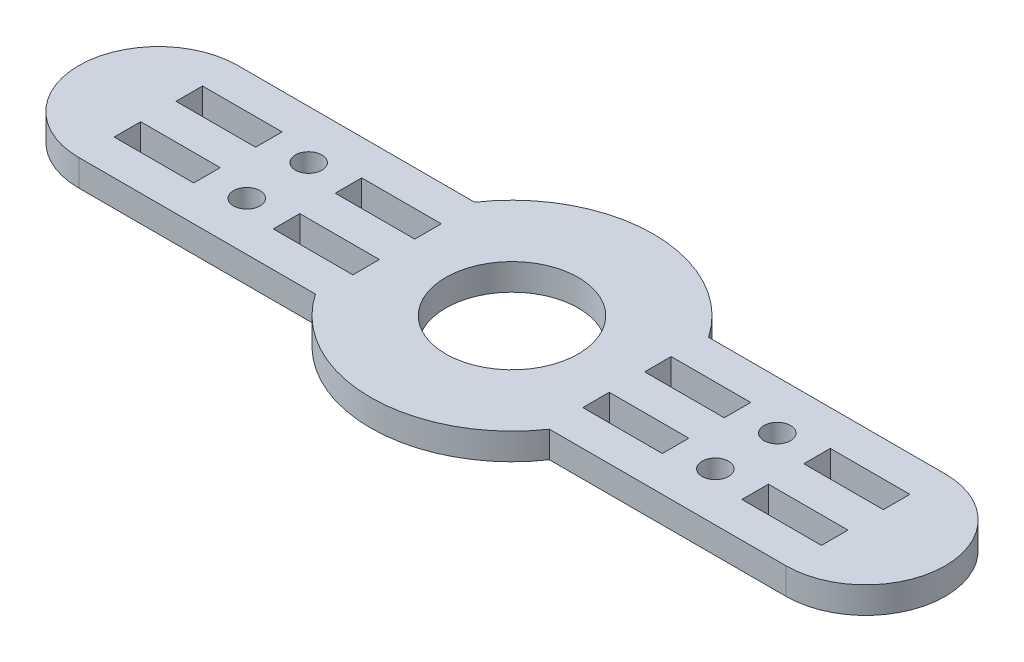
SolidWorks part; units mm, degrees
ref_plane "Front Plane" through (0, 0, 0) normal (0, 0, 1) x (1, 0, 0)
ref_plane "Top Plane" through (0, 0, 0) normal (0, 1, 0) x (1, 0, 0)
ref_plane "Right Plane" through (0, 0, 0) normal (1, 0, 0) x (0, 0, -1)
sketch "Sketch1" plane through (0, 0, 0) normal (0, 1, 0) x (1, 0, 0)
  line L0 (-40, 0) -> (40, 0) construction
  line L1 (-40, 9) -> (40, 9)
  line L2 (-40, -9) -> (40, -9)
  line L3 (-1033.412, 3.5) -> (48966.588, 3.5) construction
  line L4 (-1033.412, -3.5) -> (48966.588, -3.5) construction
  line L5 (-1000, 0) -> (49000, 0) construction
  line L6 (-22, -5) -> (-13, -5)
  line L7 (-22, -5) -> (-22, -2)
  line L8 (-22, -2) -> (-13, -2)
  line L9 (-13, -5) -> (-13, -2)
  line L10 (-22, -5) -> (-13, -2) construction
  line L11 (-22, -2) -> (-13, -5) construction
  line L12 (-40, -5) -> (-31, -5)
  line L13 (-40, -5) -> (-40, -2)
  line L14 (-40, -2) -> (-31, -2)
  line L15 (-31, -5) -> (-31, -2)
  line L16 (-40, -5) -> (-31, -2) construction
  line L17 (-40, -2) -> (-31, -5) construction
  line L18 (-40, 2) -> (-31, 5) construction
  line L19 (-40, 5) -> (-31, 2) construction
  line L20 (-22, 2) -> (-13, 5) construction
  line L21 (-22, 5) -> (-13, 2) construction
  line L22 (-31, 5) -> (-31, 2)
  line L23 (-40, 2) -> (-31, 2)
  line L24 (-40, 5) -> (-40, 2)
  line L25 (-40, 5) -> (-31, 5)
  line L26 (-13, 5) -> (-13, 2)
  line L27 (-22, 2) -> (-13, 2)
  line L28 (-22, 5) -> (-22, 2)
  line L29 (-22, 5) -> (-13, 5)
  line L30 (0, -1000) -> (0, 49000) construction
  line L31 (22, 5) -> (13, 2) construction
  line L32 (22, 2) -> (13, 5) construction
  line L33 (40, 5) -> (31, 2) construction
  line L34 (40, 2) -> (31, 5) construction
  line L35 (40, -2) -> (31, -5) construction
  line L36 (40, -5) -> (31, -2) construction
  line L37 (22, -2) -> (13, -5) construction
  line L38 (22, -5) -> (13, -2) construction
  line L39 (22, 5) -> (13, 5)
  line L40 (22, 5) -> (22, 2)
  line L41 (22, 2) -> (13, 2)
  line L42 (13, 5) -> (13, 2)
  line L43 (40, 5) -> (31, 5)
  line L44 (40, 5) -> (40, 2)
  line L45 (40, 2) -> (31, 2)
  line L46 (31, 5) -> (31, 2)
  line L47 (31, -5) -> (31, -2)
  line L48 (40, -2) -> (31, -2)
  line L49 (40, -5) -> (40, -2)
  line L50 (40, -5) -> (31, -5)
  line L51 (13, -5) -> (13, -2)
  line L52 (22, -2) -> (13, -2)
  line L53 (22, -5) -> (22, -2)
  line L54 (22, -5) -> (13, -5)
  circle A0 centre (0, 0) radius 7.5
  arc A1 (13.2288, 9) -> (-13.2288, 9) centre (0, 0) ccw
  arc A2 (-40, 9) -> (-40, -9) centre (-40, 0) ccw
  arc A3 (40, -9) -> (40, 9) centre (40, 0) ccw
  circle A4 centre (0, 0) radius 11 construction
  arc A5 (-13.2288, -9) -> (13.2288, -9) centre (0, 0) ccw
  circle A6 centre (-26.5, 3.5) radius 1.5
  circle A7 centre (-26.5, -3.5) radius 1.5
  circle A8 centre (26.5, -3.5) radius 1.5
  circle A9 centre (26.5, 3.5) radius 1.5
  point P6 (0, 0)
  point P17 (-17.5, -3.5)
  point P24 (-35.5, -3.5)
  point P39 (-35.5, 3.5)
  point P40 (-17.5, 3.5)
  point P67 (17.5, 3.5)
  point P68 (35.5, 3.5)
  point P69 (35.5, -3.5)
  point P70 (17.5, -3.5)
  dimension "D1" = 15
  dimension "D3" = 7
  dimension "D5" = 22
  dimension "D6" = 16
  dimension "D12" = 3
  dimension "D13" = 3
  dimension "D2" = 80
  dimension "D4" = 3.5
  dimension "D7" = 9
  dimension "D8" = 9
  dimension "D9" = 3
  dimension "D10" = 9
  dimension "D11" = 4.5
  dimension "D14" = 18
  dimension "D15" = 13
extrude "Boss-Extrude1" add sketch "Sketch1" along normal blind 3 contours L2 A3 L1 A2 A8 A7 A6 L53 L54 L51 L52 L49 L50 L47 L48 L28 L29 L26 L27 L24 L25 L22 L23 L9 L6 L7 L8 L15 L12 L13 L14 L42 L39 L40 L41 L46 | L2 A5 | L1 A1
